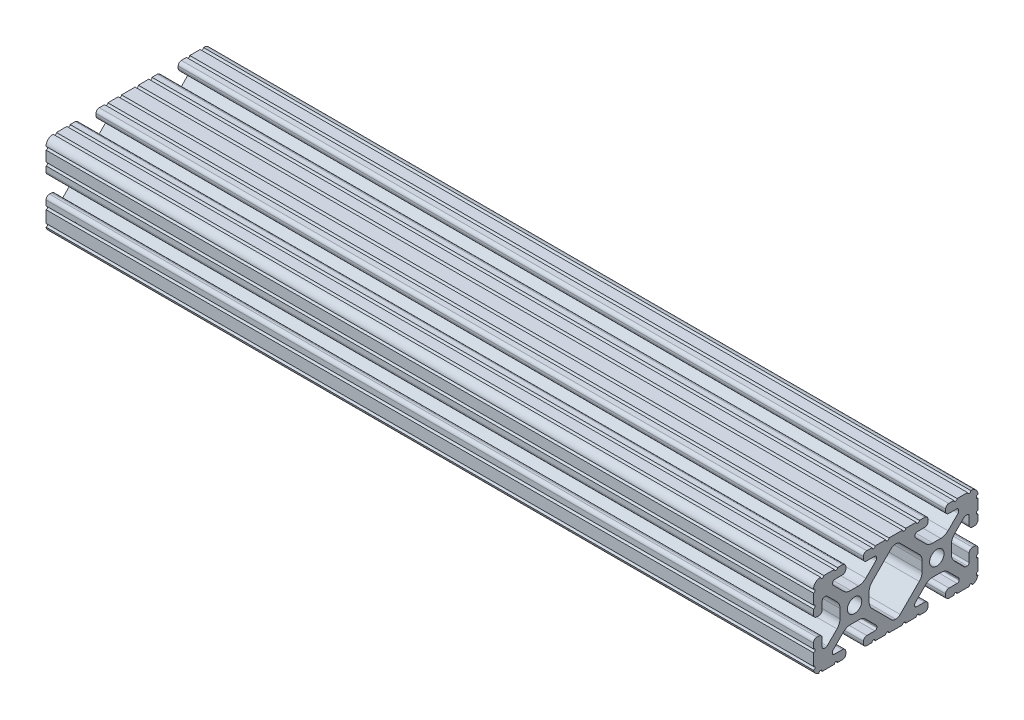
SolidWorks part; units mm, degrees
ref_plane "Front" through (0, 0, 0) normal (0, 0, 1) x (1, 0, 0)
ref_plane "Top" through (0, 0, 0) normal (0, 1, 0) x (1, 0, 0)
ref_plane "Right" through (0, 0, 0) normal (1, 0, 0) x (0, 0, -1)
sketch "Sketch1" plane through (0, 0, 0) normal (1, 0, 0) x (0, 0, -1)
  line L2 (30.3513, 26.5282) -> (39.1767, 35.3536)
  line L3 (40.5679, 38.7122) -> (40.5679, 42.8592)
  line L4 (39.1767, 46.2178) -> (30.3513, 55.0433)
  line L5 (26.1972, 55.0433) -> (17.3719, 46.2178)
  line L6 (15.9807, 42.8592) -> (15.9807, 38.7122)
  line L7 (17.3719, 35.3536) -> (26.1972, 26.5282)
  line L8 (37.19, 54.3201) -> (37.19, 54.8827)
  line L9 (38.079, 55.7717) -> (41.6855, 55.7717)
  line L10 (43.2603, 57.3465) -> (43.2603, 58.2825)
  line L11 (41.707, 59.8357) -> (39.2718, 59.8357)
  line L12 (37.7478, 59.8357) -> (32.9194, 59.8357)
  line L13 (31.3954, 59.8357) -> (25.1532, 59.8357)
  line L14 (23.6292, 59.8357) -> (18.8007, 59.8357)
  line L15 (17.2767, 59.8357) -> (14.8415, 59.8357)
  line L16 (13.2883, 58.2825) -> (13.2883, 57.3465)
  line L17 (14.8631, 55.7717) -> (18.4695, 55.7717)
  line L18 (19.3585, 54.8827) -> (19.3585, 54.3201)
  line L19 (19.0981, 53.6915) -> (14.4218, 49.0151)
  line L20 (11.0632, 47.6239) -> (7.3854, 47.6239)
  line L21 (4.0268, 49.0151) -> (-0.6496, 53.6915)
  line L22 (-0.91, 54.3201) -> (-0.91, 54.8827)
  line L23 (-0.021, 55.7717) -> (3.5855, 55.7717)
  line L24 (5.1603, 57.3465) -> (5.1603, 58.2663)
  line L25 (3.7154, 59.8357) -> (1.3285, 59.8357)
  line L26 (-0.1955, 59.8357) -> (-5.022, 59.8357)
  line L27 (-9.8257, 55.1609) -> (-9.8257, 50.3354)
  line L28 (-9.8257, 48.8114) -> (-9.8257, 46.4245)
  line L29 (-8.2509, 44.8497) -> (-7.3365, 44.8497)
  line L30 (-5.7617, 46.4245) -> (-5.7617, 50.1837)
  line L31 (-4.8727, 51.0727) -> (-4.1464, 51.0727)
  line L32 (-3.5178, 50.8123) -> (1.0767, 46.2178)
  line L33 (2.4679, 42.8592) -> (2.4679, 38.7122)
  line L34 (1.0767, 35.3536) -> (-3.5178, 30.7591)
  line L35 (-4.1464, 30.4987) -> (-4.8727, 30.4987)
  line L36 (-5.7617, 31.3877) -> (-5.7617, 35.1469)
  line L37 (-7.3365, 36.7217) -> (-8.2509, 36.7217)
  line L38 (-9.8257, 35.1469) -> (-9.8257, 32.76)
  line L39 (-9.8257, 31.236) -> (-9.8257, 25.7497)
  line L40 (-5.773, 21.7357) -> (-0.1955, 21.7357)
  line L41 (1.3285, 21.7357) -> (3.5855, 21.7357)
  line L42 (5.1603, 23.3105) -> (5.1603, 24.2249)
  line L43 (3.5855, 25.7997) -> (-0.1737, 25.7997)
  line L44 (-1.0627, 26.6887) -> (-1.0627, 27.0985)
  line L45 (-0.8023, 27.7272) -> (4.0268, 32.5563)
  line L46 (7.3854, 33.9475) -> (11.0632, 33.9475)
  line L47 (14.4218, 32.5563) -> (19.2509, 27.7272)
  line L48 (19.5113, 27.0985) -> (19.5113, 26.6887)
  line L49 (18.6223, 25.7997) -> (14.8631, 25.7997)
  line L50 (13.2883, 24.2249) -> (13.2883, 23.3105)
  line L51 (14.8631, 21.7357) -> (17.2767, 21.7357)
  line L52 (18.8007, 21.7357) -> (23.6292, 21.7357)
  line L53 (25.1532, 21.7357) -> (31.3954, 21.7357)
  line L54 (32.9194, 21.7357) -> (37.7478, 21.7357)
  line L55 (39.2718, 21.7357) -> (41.6855, 21.7357)
  line L56 (43.2603, 23.3105) -> (43.2603, 24.2249)
  line L57 (41.6855, 25.7997) -> (37.9263, 25.7997)
  line L58 (37.0373, 26.6887) -> (37.0373, 27.0985)
  line L59 (37.2977, 27.7272) -> (42.1268, 32.5563)
  line L60 (45.4854, 33.9475) -> (49.1632, 33.9475)
  line L61 (52.5218, 32.5563) -> (57.3509, 27.7272)
  line L62 (57.6113, 27.0985) -> (57.6113, 26.6887)
  line L63 (56.7223, 25.7997) -> (52.9631, 25.7997)
  line L64 (51.3883, 24.2249) -> (51.3883, 23.3105)
  line L65 (52.9631, 21.7357) -> (55.2201, 21.7357)
  line L66 (56.7441, 21.7357) -> (62.3216, 21.7357)
  line L67 (66.3743, 25.7497) -> (66.3743, 31.236)
  line L68 (66.3743, 32.76) -> (66.3743, 35.1469)
  line L69 (64.7995, 36.7217) -> (63.8851, 36.7217)
  line L70 (62.3103, 35.1469) -> (62.3103, 31.3877)
  line L71 (61.4213, 30.4987) -> (60.6949, 30.4987)
  line L72 (60.0663, 30.7591) -> (55.4719, 35.3536)
  line L73 (54.0807, 38.7122) -> (54.0807, 42.8592)
  line L74 (55.4719, 46.2178) -> (60.0663, 50.8123)
  line L75 (60.6949, 51.0727) -> (61.4213, 51.0727)
  line L76 (62.3103, 50.1837) -> (62.3103, 46.4245)
  line L77 (63.8851, 44.8497) -> (64.7995, 44.8497)
  line L78 (66.3743, 46.4245) -> (66.3743, 48.8114)
  line L79 (66.3743, 50.3354) -> (66.3743, 55.1609)
  line L80 (61.5705, 59.8357) -> (56.7441, 59.8357)
  line L81 (55.2201, 59.8357) -> (52.8332, 59.8357)
  line L82 (51.3883, 58.2663) -> (51.3883, 57.3465)
  line L83 (52.9631, 55.7717) -> (56.5695, 55.7717)
  line L84 (57.4585, 54.8827) -> (57.4585, 54.3201)
  line L85 (57.1981, 53.6915) -> (52.5218, 49.0151)
  line L86 (49.1632, 47.6239) -> (45.4854, 47.6239)
  line L87 (42.1268, 49.0151) -> (37.4504, 53.6915)
  arc A0 (39.1767, 35.3536) -> (40.5679, 38.7122) centre (35.8181, 38.7122) ccw
  arc A1 (30.3513, 55.0433) -> (28.2743, 55.8988) centre (28.2858, 52.9778) ccw
  arc A2 (28.2743, 55.8988) -> (26.1972, 55.0433) centre (28.2627, 52.9778) ccw
  arc A3 (17.3719, 46.2178) -> (15.9807, 42.8592) centre (20.7305, 42.8592) ccw
  arc A4 (15.9807, 38.7122) -> (17.3719, 35.3536) centre (20.7305, 38.7122) ccw
  arc A5 (26.1972, 26.5282) -> (28.2743, 25.6726) centre (28.2627, 28.5936) ccw
  arc A6 (28.2743, 25.6726) -> (30.3513, 26.5282) centre (28.2858, 28.5936) ccw
  circle A7 centre (47.3243, 40.7857) radius 3.3274
  circle A8 centre (9.2243, 40.7857) radius 3.3274
  arc A9 (40.5679, 42.8592) -> (39.1767, 46.2178) centre (35.8181, 42.8592) ccw
  arc A10 (38.079, 55.7717) -> (37.19, 54.8827) centre (38.079, 54.8827) ccw
  arc A11 (41.6855, 55.7717) -> (43.2603, 57.3465) centre (41.6855, 57.3465) ccw
  arc A12 (43.2603, 58.2825) -> (41.707, 59.8357) centre (41.707, 58.2825) ccw
  arc A13 (37.7478, 59.8357) -> (39.2718, 59.8357) centre (38.5098, 59.8357) ccw
  arc A14 (31.3954, 59.8357) -> (32.9194, 59.8357) centre (32.1574, 59.8357) ccw
  arc A15 (23.6292, 59.8357) -> (25.1532, 59.8357) centre (24.3912, 59.8357) ccw
  arc A16 (17.2767, 59.8357) -> (18.8007, 59.8357) centre (18.0387, 59.8357) ccw
  arc A17 (14.8415, 59.8357) -> (13.2883, 58.2825) centre (14.8415, 58.2825) ccw
  arc A18 (13.2883, 57.3465) -> (14.8631, 55.7717) centre (14.8631, 57.3465) ccw
  arc A19 (19.3585, 54.8827) -> (18.4695, 55.7717) centre (18.4695, 54.8827) ccw
  arc A20 (19.0981, 53.6915) -> (19.3585, 54.3201) centre (18.4695, 54.3201) ccw
  arc A21 (11.0632, 47.6239) -> (14.4218, 49.0151) centre (11.0632, 52.3737) ccw
  arc A22 (4.0268, 49.0151) -> (7.3854, 47.6239) centre (7.3854, 52.3737) ccw
  arc A23 (-0.91, 54.3201) -> (-0.6496, 53.6915) centre (-0.021, 54.3201) ccw
  arc A24 (-0.021, 55.7717) -> (-0.91, 54.8827) centre (-0.021, 54.8827) ccw
  arc A25 (3.5855, 55.7717) -> (5.1603, 57.3465) centre (3.5855, 57.3465) ccw
  arc A26 (5.1603, 58.2663) -> (3.7154, 59.8357) centre (3.5855, 58.2663) ccw
  arc A27 (-0.1955, 59.8357) -> (1.3285, 59.8357) centre (0.5665, 59.8357) ccw
  arc A28 (-6.5453, 59.8825) -> (-5.022, 59.8357) centre (-5.7836, 59.8591) ccw
  arc A29 (-6.5453, 59.8825) -> (-9.8633, 56.684) centre (-6.6287, 56.6488) ccw
  arc A30 (-9.8257, 55.1609) -> (-9.8633, 56.684) centre (-9.8257, 55.9229) ccw
  arc A31 (-9.8257, 48.8114) -> (-9.8257, 50.3354) centre (-9.8257, 49.5734) ccw
  arc A32 (-9.8257, 46.4245) -> (-8.2509, 44.8497) centre (-8.2509, 46.4245) ccw
  arc A33 (-7.3365, 44.8497) -> (-5.7617, 46.4245) centre (-7.3365, 46.4245) ccw
  arc A34 (-4.8727, 51.0727) -> (-5.7617, 50.1837) centre (-4.8727, 50.1837) ccw
  arc A35 (-3.5178, 50.8123) -> (-4.1464, 51.0727) centre (-4.1464, 50.1837) ccw
  arc A36 (2.4679, 42.8592) -> (1.0767, 46.2178) centre (-2.2819, 42.8592) ccw
  arc A37 (1.0767, 35.3536) -> (2.4679, 38.7122) centre (-2.2819, 38.7122) ccw
  arc A38 (-4.1464, 30.4987) -> (-3.5178, 30.7591) centre (-4.1464, 31.3877) ccw
  arc A39 (-5.7617, 31.3877) -> (-4.8727, 30.4987) centre (-4.8727, 31.3877) ccw
  arc A40 (-5.7617, 35.1469) -> (-7.3365, 36.7217) centre (-7.3365, 35.1469) ccw
  arc A41 (-8.2509, 36.7217) -> (-9.8257, 35.1469) centre (-8.2509, 35.1469) ccw
  arc A42 (-9.8257, 31.236) -> (-9.8257, 32.76) centre (-9.8257, 31.998) ccw
  arc A43 (-9.8257, 24.2257) -> (-9.8257, 25.7497) centre (-9.8257, 24.9877) ccw
  arc A44 (-9.8257, 24.2257) -> (-7.297, 21.7357) centre (-6.6712, 24.9002) ccw
  arc A45 (-5.773, 21.7357) -> (-7.297, 21.7357) centre (-6.535, 21.7357) ccw
  arc A46 (1.3285, 21.7357) -> (-0.1955, 21.7357) centre (0.5665, 21.7357) ccw
  arc A47 (3.5855, 21.7357) -> (5.1603, 23.3105) centre (3.5855, 23.3105) ccw
  arc A48 (5.1603, 24.2249) -> (3.5855, 25.7997) centre (3.5855, 24.2249) ccw
  arc A49 (-1.0627, 26.6887) -> (-0.1737, 25.7997) centre (-0.1737, 26.6887) ccw
  arc A50 (-0.8023, 27.7272) -> (-1.0627, 27.0985) centre (-0.1737, 27.0985) ccw
  arc A51 (7.3854, 33.9475) -> (4.0268, 32.5563) centre (7.3854, 29.1977) ccw
  arc A52 (14.4218, 32.5563) -> (11.0632, 33.9475) centre (11.0632, 29.1977) ccw
  arc A53 (19.5113, 27.0985) -> (19.2509, 27.7272) centre (18.6223, 27.0985) ccw
  arc A54 (18.6223, 25.7997) -> (19.5113, 26.6887) centre (18.6223, 26.6887) ccw
  arc A55 (14.8631, 25.7997) -> (13.2883, 24.2249) centre (14.8631, 24.2249) ccw
  arc A56 (13.2883, 23.3105) -> (14.8631, 21.7357) centre (14.8631, 23.3105) ccw
  arc A57 (18.8007, 21.7357) -> (17.2767, 21.7357) centre (18.0387, 21.7357) ccw
  arc A58 (25.1532, 21.7357) -> (23.6292, 21.7357) centre (24.3912, 21.7357) ccw
  arc A59 (32.9194, 21.7357) -> (31.3954, 21.7357) centre (32.1574, 21.7357) ccw
  arc A60 (39.2718, 21.7357) -> (37.7478, 21.7357) centre (38.5098, 21.7357) ccw
  arc A61 (41.6855, 21.7357) -> (43.2603, 23.3105) centre (41.6855, 23.3105) ccw
  arc A62 (43.2603, 24.2249) -> (41.6855, 25.7997) centre (41.6855, 24.2249) ccw
  arc A63 (37.0373, 26.6887) -> (37.9263, 25.7997) centre (37.9263, 26.6887) ccw
  arc A64 (37.2977, 27.7272) -> (37.0373, 27.0985) centre (37.9263, 27.0985) ccw
  arc A65 (45.4854, 33.9475) -> (42.1268, 32.5563) centre (45.4854, 29.1977) ccw
  arc A66 (52.5218, 32.5563) -> (49.1632, 33.9475) centre (49.1632, 29.1977) ccw
  arc A67 (57.6113, 27.0985) -> (57.3509, 27.7272) centre (56.7223, 27.0985) ccw
  arc A68 (56.7223, 25.7997) -> (57.6113, 26.6887) centre (56.7223, 26.6887) ccw
  arc A69 (52.9631, 25.7997) -> (51.3883, 24.2249) centre (52.9631, 24.2249) ccw
  arc A70 (51.3883, 23.3105) -> (52.9631, 21.7357) centre (52.9631, 23.3105) ccw
  arc A71 (56.7441, 21.7357) -> (55.2201, 21.7357) centre (55.9821, 21.7357) ccw
  arc A72 (63.8456, 21.7357) -> (62.3216, 21.7357) centre (63.0836, 21.7357) ccw
  arc A73 (63.8456, 21.7357) -> (66.3743, 24.2257) centre (63.2122, 24.9079) ccw
  arc A74 (66.3743, 25.7497) -> (66.3743, 24.2257) centre (66.3743, 24.9877) ccw
  arc A75 (66.3743, 32.76) -> (66.3743, 31.236) centre (66.3743, 31.998) ccw
  arc A76 (66.3743, 35.1469) -> (64.7995, 36.7217) centre (64.7995, 35.1469) ccw
  arc A77 (63.8851, 36.7217) -> (62.3103, 35.1469) centre (63.8851, 35.1469) ccw
  arc A78 (61.4213, 30.4987) -> (62.3103, 31.3877) centre (61.4213, 31.3877) ccw
  arc A79 (60.0663, 30.7591) -> (60.6949, 30.4987) centre (60.6949, 31.3877) ccw
  arc A80 (54.0807, 38.7122) -> (55.4719, 35.3536) centre (58.8305, 38.7122) ccw
  arc A81 (55.4719, 46.2178) -> (54.0807, 42.8592) centre (58.8305, 42.8592) ccw
  arc A82 (60.6949, 51.0727) -> (60.0663, 50.8123) centre (60.6949, 50.1837) ccw
  arc A83 (62.3103, 50.1837) -> (61.4213, 51.0727) centre (61.4213, 50.1837) ccw
  arc A84 (62.3103, 46.4245) -> (63.8851, 44.8497) centre (63.8851, 46.4245) ccw
  arc A85 (64.7995, 44.8497) -> (66.3743, 46.4245) centre (64.7995, 46.4245) ccw
  arc A86 (66.3743, 50.3354) -> (66.3743, 48.8114) centre (66.3743, 49.5734) ccw
  arc A87 (66.4119, 56.684) -> (66.3743, 55.1609) centre (66.3743, 55.9229) ccw
  arc A88 (66.4119, 56.684) -> (63.0938, 59.8825) centre (63.1773, 56.6488) ccw
  arc A89 (61.5705, 59.8357) -> (63.0938, 59.8825) centre (62.3322, 59.8591) ccw
  arc A90 (55.2201, 59.8357) -> (56.7441, 59.8357) centre (55.9821, 59.8357) ccw
  arc A91 (52.8332, 59.8357) -> (51.3883, 58.2663) centre (52.9631, 58.2663) ccw
  arc A92 (51.3883, 57.3465) -> (52.9631, 55.7717) centre (52.9631, 57.3465) ccw
  arc A93 (57.4585, 54.8827) -> (56.5695, 55.7717) centre (56.5695, 54.8827) ccw
  arc A94 (57.1981, 53.6915) -> (57.4585, 54.3201) centre (56.5695, 54.3201) ccw
  arc A95 (49.1632, 47.6239) -> (52.5218, 49.0151) centre (49.1632, 52.3737) ccw
  arc A96 (42.1268, 49.0151) -> (45.4854, 47.6239) centre (45.4854, 52.3737) ccw
  arc A97 (37.19, 54.3201) -> (37.4504, 53.6915) centre (38.079, 54.3201) ccw
extrude "Extrude1" add sketch "Sketch1" along normal blind 355.6
sketch "Sketch2" plane through (0, 21.7357, 0) normal (0, -1, 0) x (1, 0, 0)
  line L0 (355.6, 9.8257) -> (0, 9.8257) construction
  line L1 (0, -7.3854) -> (0, -11.0632) construction
  circle A0 centre (19.05, -9.2243) radius 3.5719
  circle A1 centre (19.05, -47.3243) radius 3.5719
  dimension "D1" = 7.1437
  dimension "D2" = 7.1437
  dimension "D3" = 19.05
  dimension "D4" = 38.1
  dimension "D5" = 19.05
extrude "Extrude2" cut sketch "Sketch2" against normal blind 38.1
